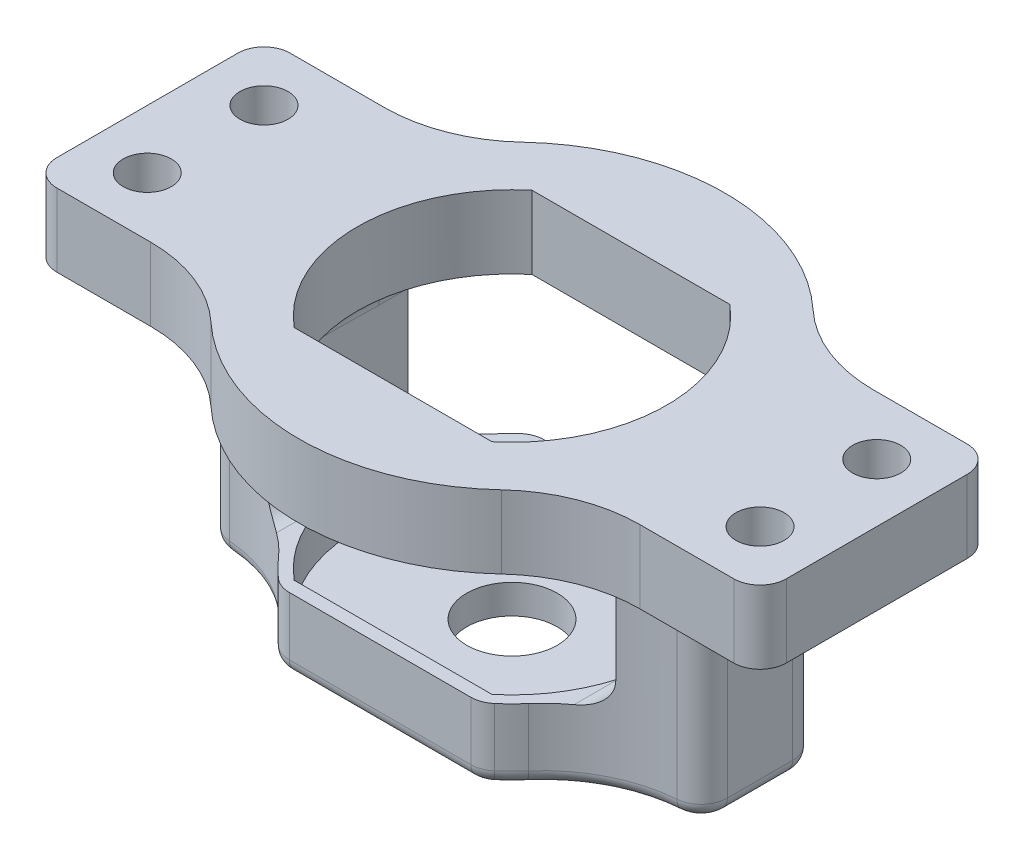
SolidWorks part; units mm, degrees
ref_plane "Front Plane" through (0, 0, 0) normal (0, 0, 1) x (1, 0, 0)
ref_plane "Top Plane" through (0, 0, 0) normal (0, 1, 0) x (1, 0, 0)
ref_plane "Right Plane" through (0, 0, 0) normal (1, 0, 0) x (0, 0, -1)
sketch "Sketch2" plane through (0, 0, 0) normal (0, 1, 0) x (1, 0, 0)
  line L0 (-12.2131, 8) -> (-25, 8)
  line L1 (-25, 8) -> (-25, -8)
  line L2 (-25, -8) -> (-12.2131, -8)
  line L3 (0, 0) -> (-57.2807, 0) construction
  line L4 (-55, 0) -> (55, 0) construction
  line L5 (12.2131, 8) -> (25, 8)
  line L6 (25, 8) -> (25, -8)
  line L7 (25, -8) -> (12.2131, -8)
  line L8 (0, 0) -> (0, 8.15) construction
  line L9 (0, -55) -> (0, 55) construction
  line L10 (-6.7777, 8.15) -> (6.7777, 8.15)
  line L11 (-6.7777, -8.15) -> (6.7777, -8.15)
  line L12 (0, 10.05) -> (0, 43.4315) construction
  line L13 (-21, 8) -> (-21, -8) construction
  line L14 (21, 8) -> (21, -8) construction
  arc A0 (-6.7777, 8.15) -> (-6.7777, -8.15) centre (0, 0) ccw
  arc A1 (-12.2131, -8) -> (12.2131, -8) centre (0, 0) ccw
  arc A2 (12.2131, 8) -> (-12.2131, 8) centre (0, 0) ccw
  arc A5 (6.7777, -8.15) -> (6.7777, 8.15) centre (0, 0) ccw
  circle A6 centre (-21, 4) radius 1.65
  circle A7 centre (-21, -4) radius 1.65
  circle A8 centre (21, 4) radius 1.65
  circle A9 centre (21, -4) radius 1.65
  point P34 (0, 0)
  point P35 (0, 0)
  dimension "D1" = 21.2
  dimension "D2" = 4
  dimension "D5" = 21
  dimension "D8" = 3.3
  dimension "D3" = 50
  dimension "D4" = 16
  dimension "D6" = 21
  dimension "D7" = 16.3
  dimension "D9" = 4
extrude "Boss-Extrude1" add sketch "Sketch2" along normal blind 5
sketch "Sketch4" plane through (0, 0, 0) normal (0, 0, 1) x (1, 0, 0)
  line L0 (0, -2.75) -> (0, 2.75) construction
  line L1 (-1, -2.765) -> (1, -2.765)
  line L2 (-1, -2.765) -> (-1, 7.8736)
  line L3 (-1, 7.8736) -> (1, 7.8736)
  line L4 (1, -2.765) -> (1, 7.8736)
  line L5 (-1, -2.765) -> (1, 7.8736) construction
  line L6 (-1, 7.8736) -> (1, -2.765) construction
  point P0 (0, 2.5543)
  dimension "D1" = 2
sketch "Sketch6" plane through (0, 0, 0) normal (1, 0, 0) x (0, 0, -1)
  line L0 (0, 2.75) -> (0, -2.75) construction
  line L1 (-18.3557, -5.0314) -> (18.3557, -5.0314)
  line L2 (-18.3557, -5.0314) -> (-18.3557, 9.6401)
  line L3 (-18.3557, 9.6401) -> (18.3557, 9.6401)
  line L4 (18.3557, -5.0314) -> (18.3557, 9.6401)
  line L5 (-18.3557, -5.0314) -> (18.3557, 9.6401) construction
  line L6 (-18.3557, 9.6401) -> (18.3557, -5.0314) construction
  point P0 (0, 2.3044)
sketch "Sketch7" plane through (0, 0, 0) normal (0, -1, 0) x (1, 0, 0)
  line L0 (55, 0) -> (-55, 0) construction
  line L1 (-12, -4) -> (-17, -4)
  line L2 (-12, -4) -> (-12, 4)
  line L3 (-12, 4) -> (-17, 4)
  line L4 (-17, -4) -> (-17, 4)
  line L5 (-12, -4) -> (-17, 4) construction
  line L6 (-12, 4) -> (-17, -4) construction
  line L7 (-25, -8) -> (-25, 8) construction
  point P0 (-14.5, 0)
  dimension "D1" = 8
  dimension "D2" = 5
  dimension "D3" = 8
extrude "Boss-Extrude2" add sketch "Sketch7" along normal blind 10
mirror "Mirror1" about plane through (0, 0, 0) normal (1, 0, 0) of "Boss-Extrude2"
ref_plane "Plane3" through (0, -10, 0) normal (0, 1, 0) x (1, 0, 0)
sketch "Sketch8" plane through (0, -10, 0) normal (0, 1, 0) x (1, 0, 0)
  line L0 (-6.8586, -9.0433) -> (6.8586, -9.0433)
  line L1 (-7.221, 8.7567) -> (7.221, 8.7567)
  line L2 (-17, 4) -> (-12, 4) construction
  line L3 (-17, -4) -> (-12, -4)
  line L4 (-17, -4) -> (-17, 4)
  line L5 (-17, 4) -> (-12, 4)
  line L7 (-12, -4) -> (-10.6218, -4)
  line L8 (12, -4) -> (17, -4)
  line L10 (12, 4) -> (17, 4)
  line L11 (17, -4) -> (17, 4)
  line L12 (-12, 4) -> (-10.6218, 4)
  line L13 (12, -4) -> (10.6218, -4)
  line L14 (12, 4) -> (10.6218, 4)
  arc A0 (6.8586, -9.0433) -> (10.6218, -4) centre (0, 0) ccw
  arc A1 (-7.221, 8.7567) -> (-10.6218, 4) centre (0, 0) ccw
  arc A2 (-10.6218, -4) -> (-6.8586, -9.0433) centre (0, 0) ccw
  arc A3 (10.6218, 4) -> (7.221, 8.7567) centre (0, 0) ccw
  dimension "D1" = 22.7
  dimension "D2" = 17.8
extrude "Boss-Extrude3" add sketch "Sketch8" against normal blind 5
fillet "Fillet1" radius 10 8 edges at (-12.2131, 2.5, -8) (-12.2131, 2.5, 8) (12.2131, 2.5, 8) (12.2131, 2.5, -8) (-10.6218, -12.5, 4) (10.6218, -12.5, 4) (10.6218, -12.5, -4) (-10.6218, -12.5, -4)
fillet "Fillet2" radius 1.8 14 edges at (-25, 2.5, -8) (-25, 2.5, 8) (25, 2.5, -8) (25, 2.5, 8) (-6.8586, -12.5, 9.0433) (6.8586, -12.5, 9.0433) (-7.221, -12.5, -8.7567) (7.221, -12.5, -8.7567) (17, -7.5, -4) (17, -7.5, 4) (-17, -7.5, -4) (-17, -7.5, 4) (-12, -10, 0) (12, -10, 0)
sketch "Sketch9" plane through (0, -10, 0) normal (0, 1, 0) x (1, 0, 0)
  line L0 (-6.7777, 8.15) -> (6.7777, 8.15)
  line L1 (-6.7777, -8.15) -> (6.7777, -8.15)
  line L2 (0, 0) -> (29.725, 0) construction
  line L3 (-11, 0) -> (11, 0) construction
  arc A0 (-6.7777, 8.15) -> (-6.7777, -8.15) centre (0, 0) ccw
  arc A1 (6.7777, -8.15) -> (6.7777, 8.15) centre (0, 0) ccw
  dimension "D1" = 21.2
  dimension "D2" = 16.3
extrude "Cut-Extrude1" cut sketch "Sketch9" against normal blind 3
sketch "Sketch10" plane through (0, -15, 0) normal (0, -1, 0) x (1, 0, 0)
  circle A0 centre (0, 0) radius 3.1
  dimension "D1" = 6.2
extrude "Cut-Extrude2" cut sketch "Sketch10" against normal up to next
fillet "Fillet4" radius 1.8 12 edges at (13.6329, 0, -4.314) (16.5214, 0, -3.4581) (17, 0, 0) (16.5214, 0, 3.4581) (-13.6329, 0, -4.314) (-16.5214, 0, -3.4581) (-17, 0, 0) (-16.5214, 0, 3.4581) (12, 0, 0) (13.6329, 0, 4.314) (-12, 0, 0) (-13.6329, 0, 4.314)
fillet "Fillet5" radius 1 20 edges at (-8.0043, -15, 8.047) (-6.8494, -15, 8.9312) (0, -15, 9.0433) (6.8494, -15, 8.9312) (8.0043, -15, 8.047) (11.6187, -15, 5.0699) (16.5214, -15, 3.4581) (17, -15, 0) (16.5214, -15, -3.4581) (11.6187, -15, -5.0699) (8.1829, -15, -7.8652) (7.206, -15, -8.63) (0, -15, -8.7567) (-7.206, -15, -8.63) (-8.1829, -15, -7.8652) (-11.6187, -15, -5.0699) (-16.5214, -15, -3.4581) (-17, -15, 0) (-16.5214, -15, 3.4581) (-11.6187, -15, 5.0699)
sketch "Sketch11" plane through (-17, 0, 0) normal (-1, 0, 0) x (0, 0, 1)
  line L0 (-2.2358, 0) -> (2.2358, 0) construction
  circle A0 centre (0, -5) radius 1.6
  dimension "D1" = 3.2
  dimension "D2" = 5
extrude "Cut-Extrude3" cut sketch "Sketch11" against normal blind 3
mirror "Mirror2" about plane through (0, 0, 0) normal (1, 0, 0) of "Cut-Extrude3"
